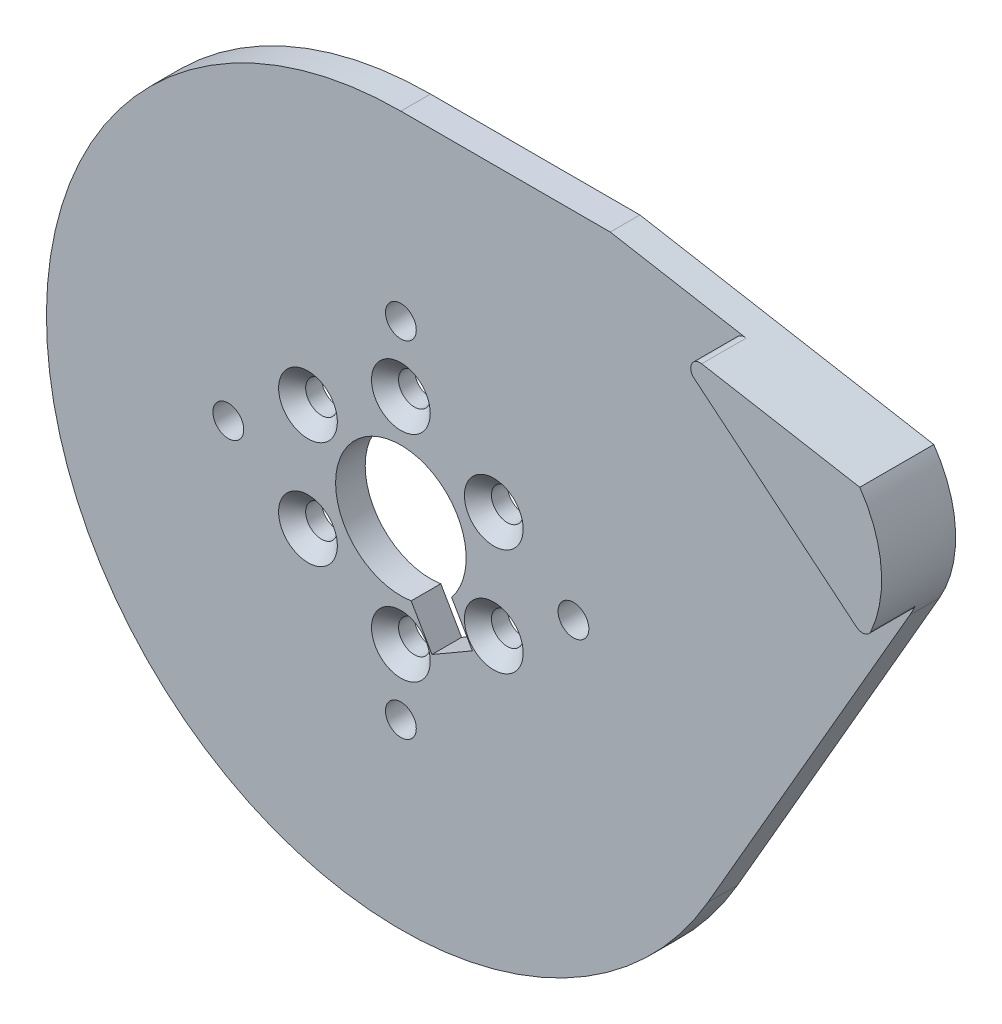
SolidWorks part; units mm, degrees
ref_plane "Front Plane" through (0, 0, 0) normal (0, 0, 1) x (1, 0, 0)
ref_plane "Top Plane" through (0, 0, 0) normal (0, 1, 0) x (1, 0, 0)
ref_plane "Right Plane" through (0, 0, 0) normal (1, 0, 0) x (0, 0, -1)
ref_plane "Plane1" through (0, 0, 3.175) normal (0, 0, 1) x (1, 0, 0)
sketch "Sketch1" plane through (0, 0, 3.175) normal (0, 0, 1) x (1, 0, 0)
  line L0 (53.9595, 32.4433) -> (22.4457, 38)
  line L1 (22.4457, 38) -> (0, 38)
  line L2 (32.909, -19) -> (54.5596, 18.5)
  arc A0 (54.5596, 18.5) -> (53.9595, 32.4433) centre (43.3013, 25) ccw
  arc A1 (0, 38) -> (32.909, -19) centre (0, 0) ccw
extrude "Boss-Extrude1" add sketch "Sketch1" against normal blind 3.175
sketch "Sketch2" plane through (0, 0, 0) normal (0, 0, -1) x (-1, 0, 0)
  line L0 (-7.6651, -8.2763) -> (-3.3349, -10.7763)
  line L1 (-3.3349, -10.7763) -> (-1.1041, -6.9124)
  line L2 (-5.4342, -4.4124) -> (-7.6651, -8.2763)
  arc A0 (-1.1041, -6.9124) -> (-5.4342, -4.4124) centre (0, 0) cw
extrude "Cut-Extrude1" cut sketch "Sketch2" against normal through all
sketch "Sketch3" plane through (0, 0, 3.175) normal (0, 0, 1) x (1, 0, 0)
  line L0 (37.0091, 35.4321) -> (53.9595, 32.4433)
  line L1 (53.6014, 19.292) -> (36.1984, 33.6765)
  arc A0 (36.1984, 33.6765) -> (37.0091, 35.4321) centre (36.8355, 34.4473) cw
  arc A1 (53.9595, 32.4433) -> (55.15, 19.6513) centre (43.3013, 25) cw
  arc A2 (55.15, 19.6513) -> (53.6014, 19.292) centre (54.2385, 20.0628) cw
extrude "Boss-Extrude2" add sketch "Sketch3" along normal blind 4.7625
ref_plane "Plane2" through (0, 0, 0) normal (0, -1, 0) x (1, 0, 0)
sketch "Sketch4" plane through (0, 0, 0) normal (0, -1, 0) x (1, 0, 0)
  line L0 (7, 3.175) -> (0, 3.175)
  line L1 (0, 3.175) -> (0, 0)
  line L2 (0, 0) -> (7, 0)
  line L3 (7, 0) -> (7, 3.175)
  line L4 (0, 3.175) -> (0, 0) construction
revolve "Cut-Revolve1" cut sketch "Sketch4" angle 360 about L4
hole_wizard "#4 Clearance Hole1" positions "Sketch6" profile "Sketch5" hole size "#4" standard "ANSI Inch"
sketch "Sketch6" plane through (0, 0, 3.175) normal (0, 0, 1) x (1, 0, 0)
  point P0 (18.5, 0)
  point P1 (0, -18.5)
  point P2 (-18.5, 0)
  point P3 (0, 18.5)
sketch "Sketch5" plane through (18.5, 0, 3.175) normal (1, 0, 0) x (0, -1, 0)
  line L0 (0, 0) -> (0, 3.175)
  line L1 (0, 3.175) -> (1.65, 3.175)
  line L2 (1.65, 3.175) -> (1.65, 0)
  line L5 (1.65, 0) -> (0, 0)
  line L11 (0, -6.35) -> (0, 107.95) construction
  dimension "Thru Hole Dia." = 3.3
  dimension "Thru Hole Depth" = 3.175
hole_wizard "CSK for #4 Flat Head Machine Screw (100)1" positions "Sketch8" profile "Sketch7" countersink size "#4" standard "ANSI Inch"
sketch "Sketch8" plane through (0, 0, 3.175) normal (0, 0, 1) x (1, 0, 0)
  point P0 (-9.9593, 5.75)
  point P1 (-9.9593, -5.75)
  point P2 (0, -11.5)
  point P3 (9.9593, -5.75)
  point P4 (9.9593, 5.75)
  point P5 (0, 11.5)
sketch "Sketch7" plane through (-9.9593, 5.75, 3.175) normal (1, 0, 0) x (0, -1, 0)
  line L0 (0, 0) -> (0, 3.175)
  line L1 (0, 3.175) -> (1.7, 3.175)
  line L2 (1.7, 3.175) -> (1.7, 1.45)
  line L3 (1.7, 1.45) -> (3.15, 0)
  line L5 (3.15, 0) -> (0, 0)
  line L6 (-1.7, 1.45) -> (-3.15, 0) construction
  line L11 (0, -6.35) -> (0, 107.95) construction
  dimension "Thru Hole Dia." = 3.4
  dimension "Thru Hole Depth" = 3.175
  dimension "Near C'Sink Dia." = 6.3
  dimension "Near C'Sink Angle" = 90
